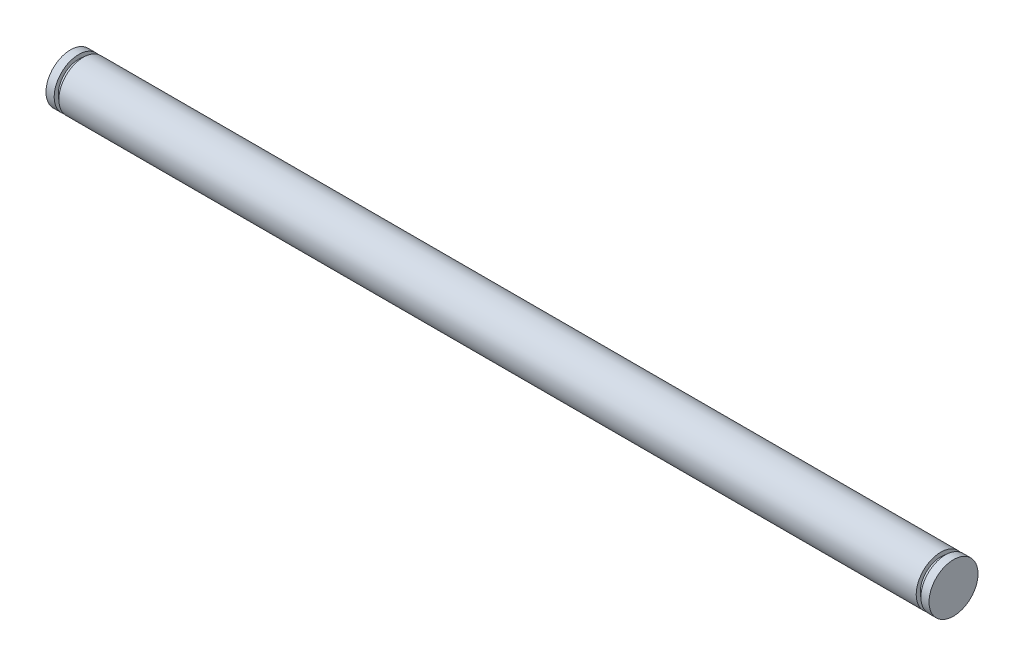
SolidWorks part; units mm, degrees
ref_plane "正面" through (0, 0, 0) normal (0, 0, 1) x (1, 0, 0)
ref_plane "平面" through (0, 0, 0) normal (0, 1, 0) x (1, 0, 0)
ref_plane "右側面" through (0, 0, 0) normal (1, 0, 0) x (0, 0, -1)
sketch "layout" plane through (0, 0, 0) normal (1, 0, 0) x (0, 0, -1)
  circle A0 centre (0, 0) radius 6
  circle A1 centre (0, 0) radius 5
  dimension "D1" = 12
  dimension "D2" = 10
sketch "ｽｹｯﾁ2" plane through (0, 0, 0) normal (1, 0, 0) x (0, 0, -1)
  circle A0 centre (0, 0) radius 6 construction
  circle A1 centre (0, 0) radius 6
extrude "押し出し1" add sketch "ｽｹｯﾁ2" along normal blind 216.3
sketch "ｽｹｯﾁ3" plane through (0, 0, 0) normal (1, 0, 0) x (0, 0, -1)
  circle A0 centre (0, 0) radius 5 construction
  circle A1 centre (0, 0) radius 5
extrude "ｶｯﾄ - 押し出し1" cut sketch "ｽｹｯﾁ3" along normal blind 1.15 from offset 2 flip side to cut
sketch "ｽｹｯﾁ4" plane through (216.3, 0, 0) normal (1, 0, 0) x (0, 0, -1)
  circle A0 centre (0, 0) radius 5 construction
  circle A1 centre (0, 0) radius 5
extrude "ｶｯﾄ - 押し出し2" cut sketch "ｽｹｯﾁ4" against normal blind 1.15 from offset 2 flip side to cut
